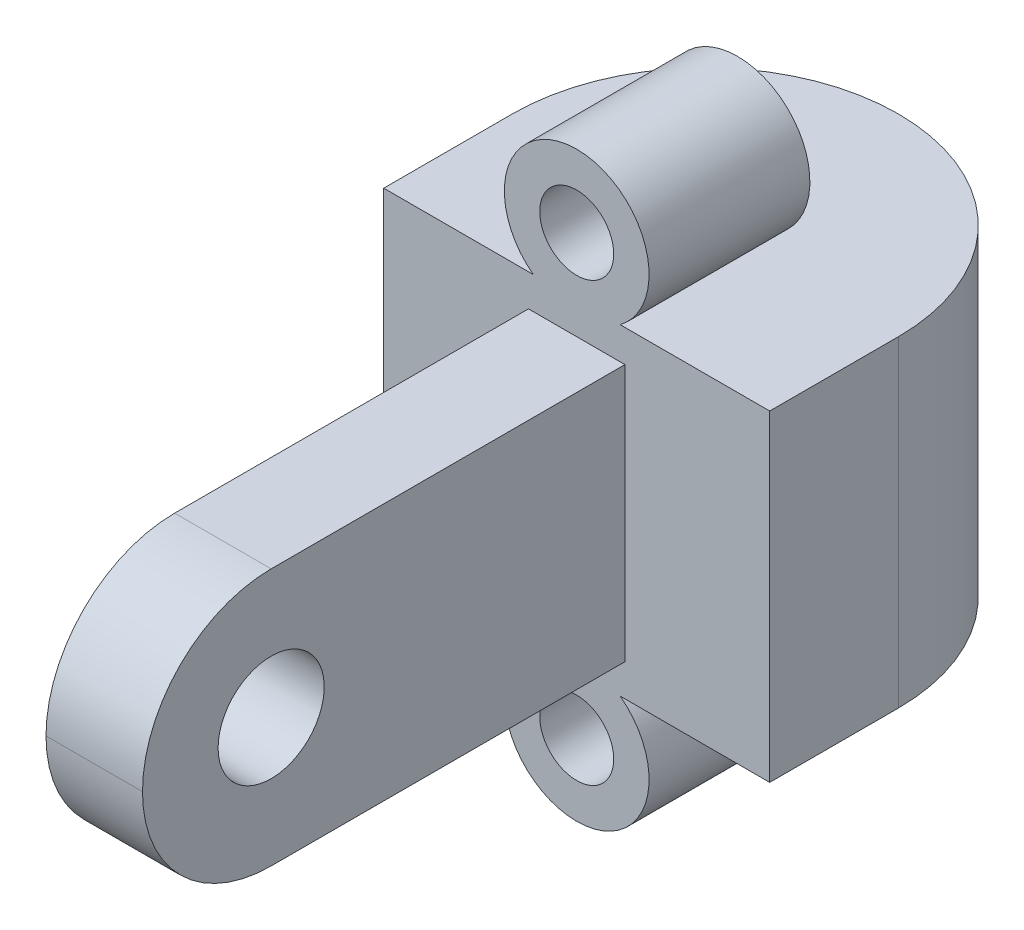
SolidWorks part; units mm, degrees
ref_plane "Front Plane" through (0, 0, 0) normal (0, 0, 1) x (1, 0, 0)
ref_plane "Top Plane" through (0, 0, 0) normal (0, 1, 0) x (1, 0, 0)
ref_plane "Right Plane" through (0, 0, 0) normal (1, 0, 0) x (0, 0, -1)
sketch "Sketch1" plane through (0, 0, 0) normal (0, 1, 0) x (1, 0, 0)
  line L1 (4.5, 0) -> (7.5, 0)
  line L2 (0, 15) -> (0, 19)
  line L4 (12, 15) -> (12, 19)
  line L7 (0, 15) -> (4.5, 15)
  line L8 (4.5, 0) -> (4.5, 15)
  line L11 (12, 15) -> (7.5, 15)
  line L12 (7.5, 0) -> (7.5, 15)
  arc A0 (12, 19) -> (0, 19) centre (6, 19) ccw
  dimension "D1" = 12
  dimension "D3" = 3
  dimension "D4" = 15
  dimension "D5" = 4.5
  dimension "D6" = 15
  dimension "D7" = 6
extrude "Boss-Extrude1" add sketch "Sketch1" along normal blind 10
sketch "Sketch3" plane through (0, 10, 0) normal (0, 1, 0) x (1, 0, 0)
  line L1 (4.5, 15) -> (7.5, 15)
  line L2 (4.5, 15) -> (4.5, 0)
  line L3 (4.5, 0) -> (7.5, 0)
  line L4 (7.5, 15) -> (7.5, 0)
extrude "Cut-Extrude1" cut sketch "Sketch3" against normal blind 1
sketch "Sketch4" plane through (0, 0, 0) normal (0, -1, 0) x (1, 0, 0)
  line L1 (4.5, 0) -> (7.5, 0)
  line L2 (4.5, 0) -> (4.5, -15)
  line L3 (4.5, -15) -> (7.5, -15)
  line L4 (7.5, 0) -> (7.5, -15)
extrude "Cut-Extrude2" cut sketch "Sketch4" against normal blind 1
sketch "Sketch5" plane through (4.5, 0, 0) normal (-1, 0, 0) x (0, 0, 1)
  line L0 (0, 9) -> (0, 1) construction
  line L1 (0, 1) -> (-15, 1) construction
  circle A0 centre (-4, 5) radius 1.65
  dimension "D1" = 3.3
  dimension "D2" = 4
  dimension "D3" = 4
extrude "Cut-Extrude3" cut sketch "Sketch5" against normal through all
fillet "Fillet1" radius 4 2 edges at (6, 1, 0) (6, 9, 0)
sketch "Sketch6" plane through (0, 0, -15) normal (0, 0, 1) x (1, 0, 0)
  line L0 (0, 10) -> (12, 10) construction
  line L1 (0, 0) -> (12, 0) construction
  line L2 (12, 10) -> (12, 0) construction
  circle A0 centre (6, 11.8) radius 2.25
  circle A1 centre (6, -1.8) radius 2.25
  dimension "D1" = 4.5
  dimension "D2" = 4.5
  dimension "D3" = 1.8
  dimension "D4" = 1.8
  dimension "D5" = 6
  dimension "D6" = 6
extrude "Boss-Extrude2" add sketch "Sketch6" against normal blind 5
sketch "Sketch7" plane through (0, 0, -15) normal (0, 0, 1) x (1, 0, 0)
  circle A0 centre (6, 11.8) radius 1.15
  circle A1 centre (6, -1.8) radius 1.15
  arc A2 (4.65, 0) -> (7.35, 0) centre (6, -1.8) ccw construction
  arc A3 (7.35, 10) -> (4.65, 10) centre (6, 11.8) ccw construction
  dimension "D1" = 2.3
  dimension "D2" = 2.3
  dimension "D3" = 0
  dimension "D4" = 0
extrude "Cut-Extrude4" cut sketch "Sketch7" against normal blind 5
